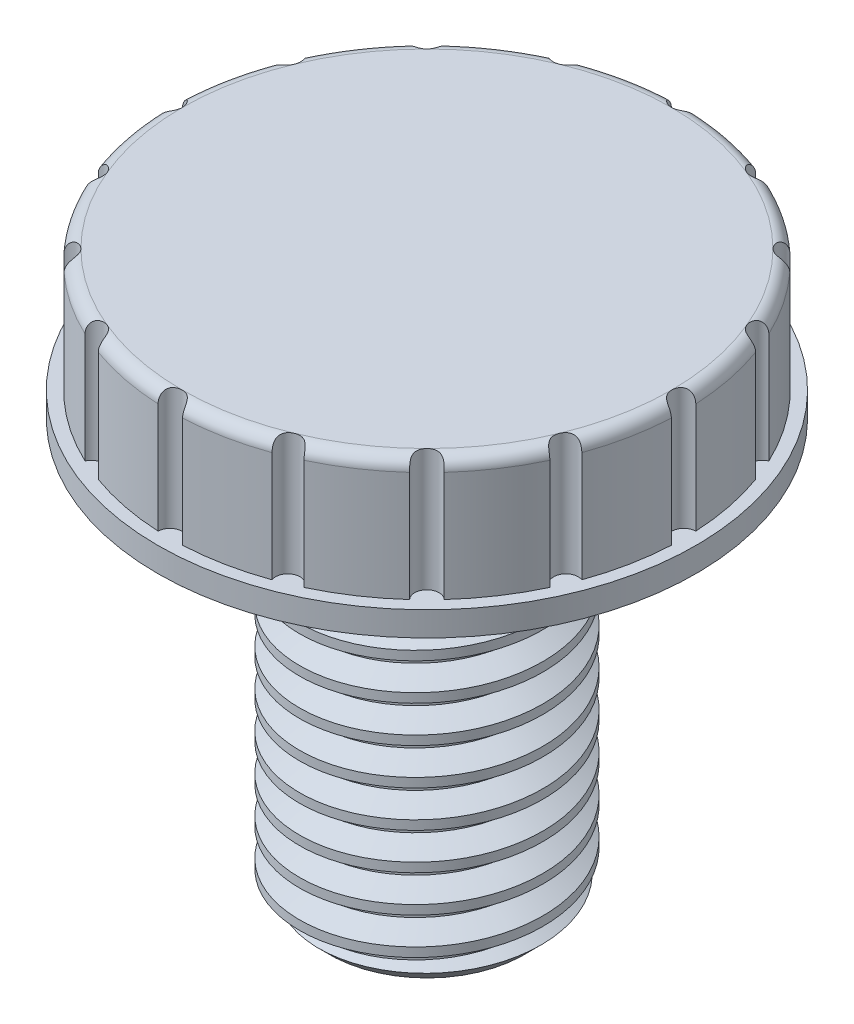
SolidWorks part; units mm, degrees
ref_plane "Front Plane" through (0, 0, 0) normal (0, 0, 1) x (1, 0, 0)
ref_plane "Top Plane" through (0, 0, 0) normal (0, 1, 0) x (1, 0, 0)
ref_plane "Right Plane" through (0, 0, 0) normal (1, 0, 0) x (0, 0, -1)
sketch "Esquisse2" plane through (0, 0, 6) normal (0, -1, 0) x (1, 0, 0)
  circle A0 centre (0, -6) radius 4.975
  dimension "D1" = 9.95
extrude "Boss.-Extru.2" add sketch "Esquisse2" along normal blind 17
chamfer "Chanfrein1" distance 1 angle 45 1 edges at (0, -17, -4.975)
thread "Filetage1" pitch 1.5 start angle 0, offset 2, length 0, pitch 1.5, diameter 9.95
ref_plane "Plan1" through (4.975, -18, 0) normal (0, 0, 1) x (1, 0, 0)
sketch "Profil de filetage1" plane through (4.975, -18, 0) normal (0, 0, 1) x (1, 0, 0)
  line L0 (0, 0) -> (0, 1.5) construction
  line L1 (0, 1.125) -> (-0.8119, 0.6563)
  line L2 (-0.8119, 0.6563) -> (-0.8119, 0.4688)
  line L3 (-0.8119, 0.4688) -> (0, 0)
  line L4 (-0.8119, 0.5625) -> (0, 0.5625) construction
  line L11 (0, 1.125) -> (0, 0)
  point P6 (0, 0)
  dimension "Pitch" = 1.5
  dimension "Profile_Angle" = 60
  dimension "Profile_Land" = 0.1875
  dimension "Profile_Height" = 0.8119
sketch "Esquisse3" plane through (0, 0, 0) normal (0, 1, 0) x (1, 0, 0)
  circle A0 centre (0, 0) radius 11
  dimension "D1" = 22
extrude "Boss.-Extru.3" add sketch "Esquisse3" along normal blind 6
sketch "Esquisse5" plane through (0, 6, 0) normal (0, 1, 0) x (1, 0, 0)
  circle A0 centre (0, 0) radius 10.5
  circle A1 centre (0, 0) radius 11 construction
  dimension "D1" = 0.5
extrude "Enlèv. mat.-Extru.2" cut sketch "Esquisse5" against normal offset from surface (5 mm away) 1 flip side to cut
fillet "Congé1" radius 0.5 1 edges at (0, 6, 10.5)
sketch "Esquisse4" plane through (0, 6, 0) normal (0, 1, 0) x (1, 0, 0)
  circle A0 centre (0, 10.5) radius 0.5
  circle A3 centre (4.0182, 9.7007) radius 0.5
  circle A4 centre (7.4246, 7.4246) radius 0.5
  circle A5 centre (9.7007, 4.0182) radius 0.5
  circle A6 centre (10.5, 0) radius 0.5
  circle A7 centre (9.7007, -4.0182) radius 0.5
  circle A8 centre (7.4246, -7.4246) radius 0.5
  circle A9 centre (4.0182, -9.7007) radius 0.5
  circle A10 centre (0, -10.5) radius 0.5
  circle A11 centre (-4.0182, -9.7007) radius 0.5
  circle A12 centre (-7.4246, -7.4246) radius 0.5
  circle A13 centre (-9.7007, -4.0182) radius 0.5
  circle A14 centre (-10.5, 0) radius 0.5
  circle A15 centre (-9.7007, 4.0182) radius 0.5
  circle A16 centre (-7.4246, 7.4246) radius 0.5
  circle A17 centre (-4.0182, 9.7007) radius 0.5
  circle A22 centre (0, 0) radius 10.5 construction
  point P46 (0, 0)
  dimension "D1" = 1
  dimension "D2" = 16
extrude "Enlèv. mat.-Extru.1" cut sketch "Esquisse4" against normal up to surface (5 mm away)
